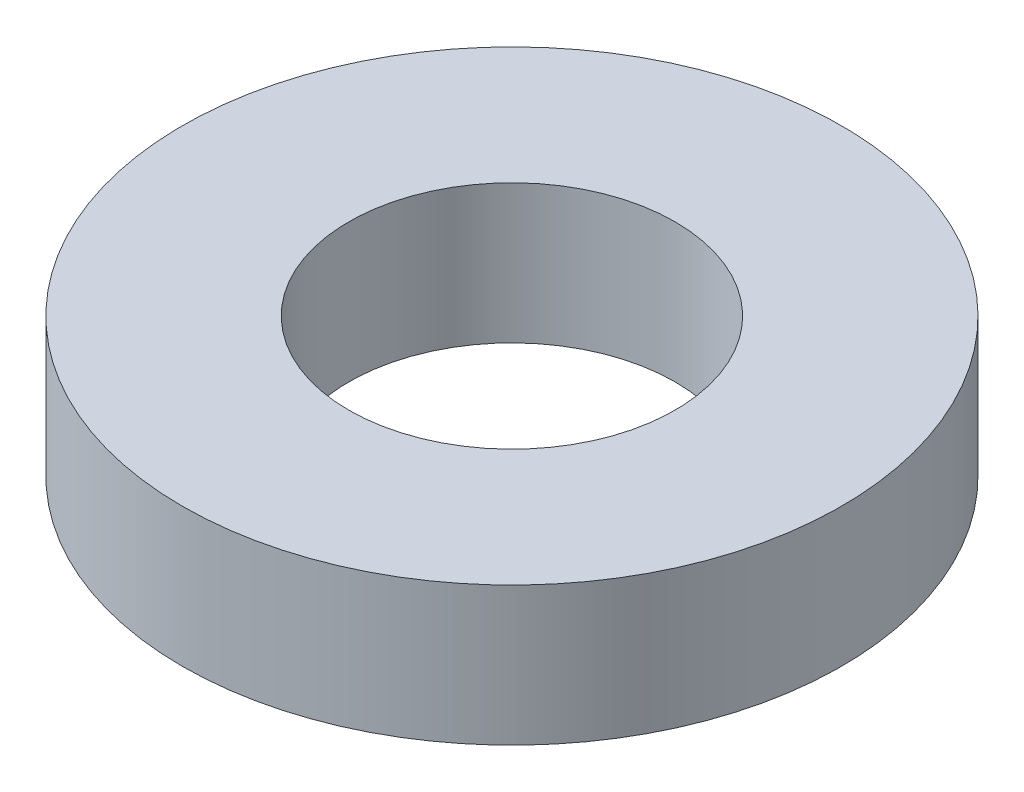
SolidWorks part; units mm, degrees
ref_plane "前视基准面" through (0, 0, 0) normal (0, 0, 1) x (1, 0, 0)
ref_plane "上视基准面" through (0, 0, 0) normal (0, 1, 0) x (1, 0, 0)
ref_plane "右视基准面" through (0, 0, 0) normal (1, 0, 0) x (0, 0, -1)
sketch "草图1" plane through (0, 0, 0) normal (0, 1, 0) x (1, 0, 0)
  circle A0 centre (0, 0) radius 40.4
  circle A1 centre (0, 0) radius 20
  dimension "D1" = 40
  dimension "D2" = 80.8
extrude "凸台-拉伸1" add sketch "草图1" along normal blind 17 contours A1 | A0
